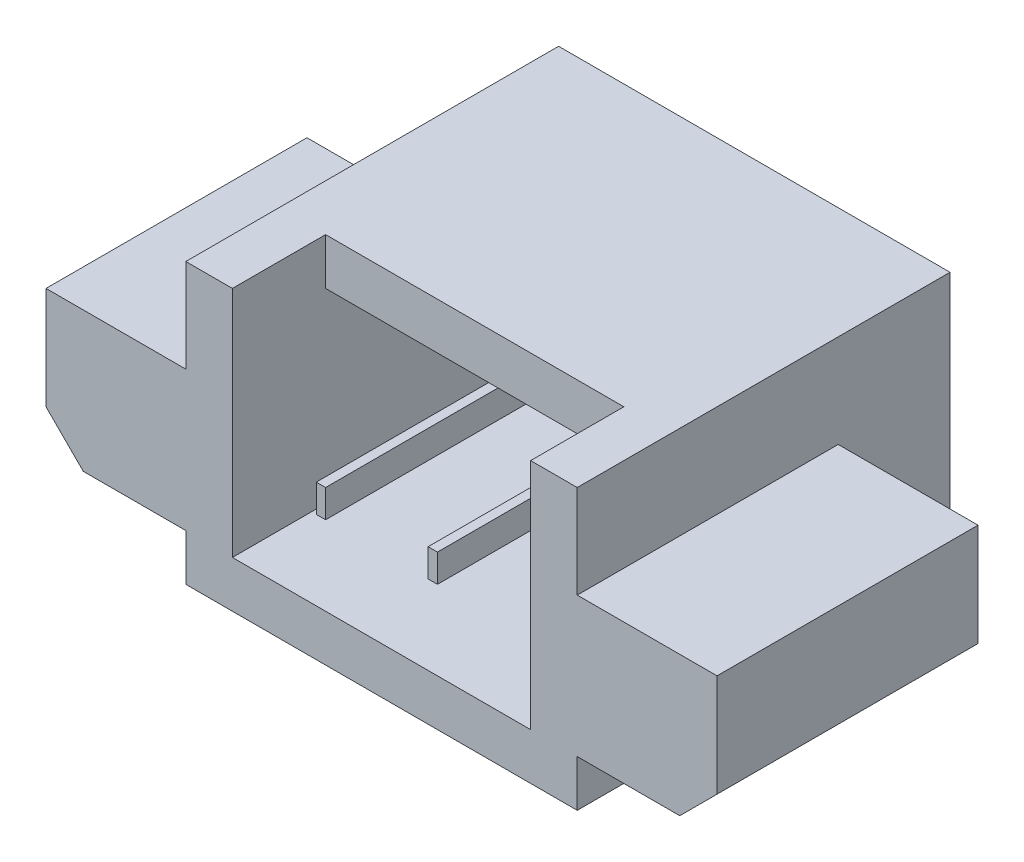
SolidWorks part; units mm, degrees
ref_plane "前视基准面" through (0, 0, 0) normal (0, 0, 1) x (1, 0, 0)
ref_plane "上视基准面" through (0, 0, 0) normal (0, 1, 0) x (1, 0, 0)
ref_plane "右视基准面" through (0, 0, 0) normal (1, 0, 0) x (0, 0, -1)
sketch "草图1" plane through (0, 0, 0) normal (0, 0, 1) x (1, 0, 0)
  line L0 (-1.6, -1) -> (1.6, -1)
  line L1 (-2.1, 1.5) -> (2.1, 1.5)
  line L2 (-2.1, 1.5) -> (-2.1, -1.5)
  line L3 (-2.1, -1.5) -> (2.1, -1.5)
  line L4 (2.1, 1.5) -> (2.1, -1.5)
  line L5 (-2.1, 1.5) -> (2.1, -1.5) construction
  line L6 (-2.1, -1.5) -> (2.1, 1.5) construction
  line L7 (1.6, 1) -> (1.6, -1)
  line L8 (-1.6, 1) -> (1.6, 1)
  line L9 (-1.6, 1) -> (-1.6, -1)
  point P0 (0, 0)
  dimension "D1" = 4.2
  dimension "D2" = 3
  dimension "D3" = 0.5
extrude "凸台-拉伸1" add sketch "草图1" along normal blind 4
sketch "草图2" plane through (0, 0, 4) normal (0, 0, 1) x (1, 0, 0)
  line L0 (0, 2.8403) -> (0, -3.2921) construction
  line L1 (-2.1, 1.5) -> (-2.1, -1.5) construction
  line L2 (-2.1, -1) -> (-3.2, -1)
  line L3 (-2.1, -1) -> (-2.1, 0.5)
  line L4 (-2.1, 0.5) -> (-3.6, 0.5)
  line L5 (-3.6, -0.6) -> (-3.6, 0.5)
  line L6 (-2.1, -1.5) -> (2.1, -1.5) construction
  line L7 (2.1, -1) -> (2.1, 0.5)
  line L8 (2.1, 0.5) -> (3.6, 0.5)
  line L9 (3.6, -0.6) -> (3.6, 0.5)
  line L10 (2.1, -1) -> (3.2, -1)
  line L11 (-3.2, -1) -> (-3.6, -0.6)
  line L12 (3.2, -1) -> (3.6, -0.6)
  point P6 (-3.6, -1)
  point P14 (3.6, -1)
  dimension "D1" = 1.5
  dimension "D2" = 0.5
  dimension "D3" = 1.5
extrude "凸台-拉伸2" add sketch "草图2" against normal blind 2.8
sketch "草图3" plane through (0, 0, 0) normal (0, 0, -1) x (-1, 0, 0)
  line L1 (2.1, -1.5) -> (-2.1, -1.5)
  line L2 (2.1, -1.5) -> (2.1, 1.5)
  line L3 (2.1, 1.5) -> (-2.1, 1.5)
  line L4 (-2.1, -1.5) -> (-2.1, 1.5)
extrude "凸台-拉伸3" add sketch "草图3" against normal blind 0.5
sketch "草图5" plane through (0, 1.5, 0) normal (0, 1, 0) x (1, 0, 0)
  line L0 (2.1, -4) -> (-2.1, -4) construction
  line L1 (-1.6, -4) -> (1.6, -4)
  line L2 (-1.6, -4) -> (-1.6, -3)
  line L3 (-1.6, -3) -> (1.6, -3)
  line L4 (1.6, -4) -> (1.6, -3)
  line L5 (-2.1, -4) -> (-2.1, 0) construction
  line L6 (2.1, -4) -> (2.1, 0) construction
  dimension "D1" = 0.5
  dimension "D2" = 0.5
  dimension "D3" = 1
extrude "切除-拉伸1" cut sketch "草图5" against normal blind 0.5
sketch "草图6" plane through (0, 0, 0.5) normal (0, 0, 1) x (1, 0, 0)
  line L0 (-6.6592, 0) -> (5.8992, 0) construction
  line L1 (0, 2.7397) -> (0, -3.375) construction
  line L2 (0.5, 0.15) -> (0.5, -0.15)
  line L3 (-0.7, 0.15) -> (-0.6, 0.15)
  line L4 (-0.7, 0.15) -> (-0.7, -0.15)
  line L5 (-0.7, -0.15) -> (-0.6, -0.15)
  line L6 (-0.6, 0.15) -> (-0.6, -0.15)
  line L7 (-0.7, 0.15) -> (-0.6, -0.15) construction
  line L8 (-0.7, -0.15) -> (-0.6, 0.15) construction
  line L9 (0.5, 0.15) -> (0.6, 0.15)
  line L10 (0.6, 0.15) -> (0.6, -0.15)
  line L11 (0.5, -0.15) -> (0.6, -0.15)
  line L24 (-1.6, 1.5) -> (-1.6, -1) construction
  line L25 (4.1, -0.15) -> (4.2, -0.15)
  line L26 (4.1, 0.15) -> (4.1, 0)
  line L27 (4.1, 0.15) -> (4.2, 0.15)
  line L28 (4.2, 0) -> (4.2, -0.15)
  line L29 (2.9, 0.15) -> (3, 0.15)
  line L30 (3, 0) -> (3, -0.15)
  line L31 (2.9, 0) -> (2.9, -0.15)
  line L32 (2.9, -0.15) -> (3, -0.15)
  line L33 (1.7, 0.15) -> (1.8, 0.15)
  line L34 (1.8, 0) -> (1.8, -0.15)
  line L35 (1.7, 0) -> (1.7, -0.15)
  line L36 (1.7, -0.15) -> (1.8, -0.15)
  point P5 (-0.65, 0)
  point P28 (-1.6, 0.25)
  dimension "D1" = 0.1
  dimension "D2" = 0.3
  dimension "D4" = 0.9
  dimension "D3" = 5
extrude "凸台-拉伸4" add sketch "草图6" along normal up to vertex (3.5 mm away)
